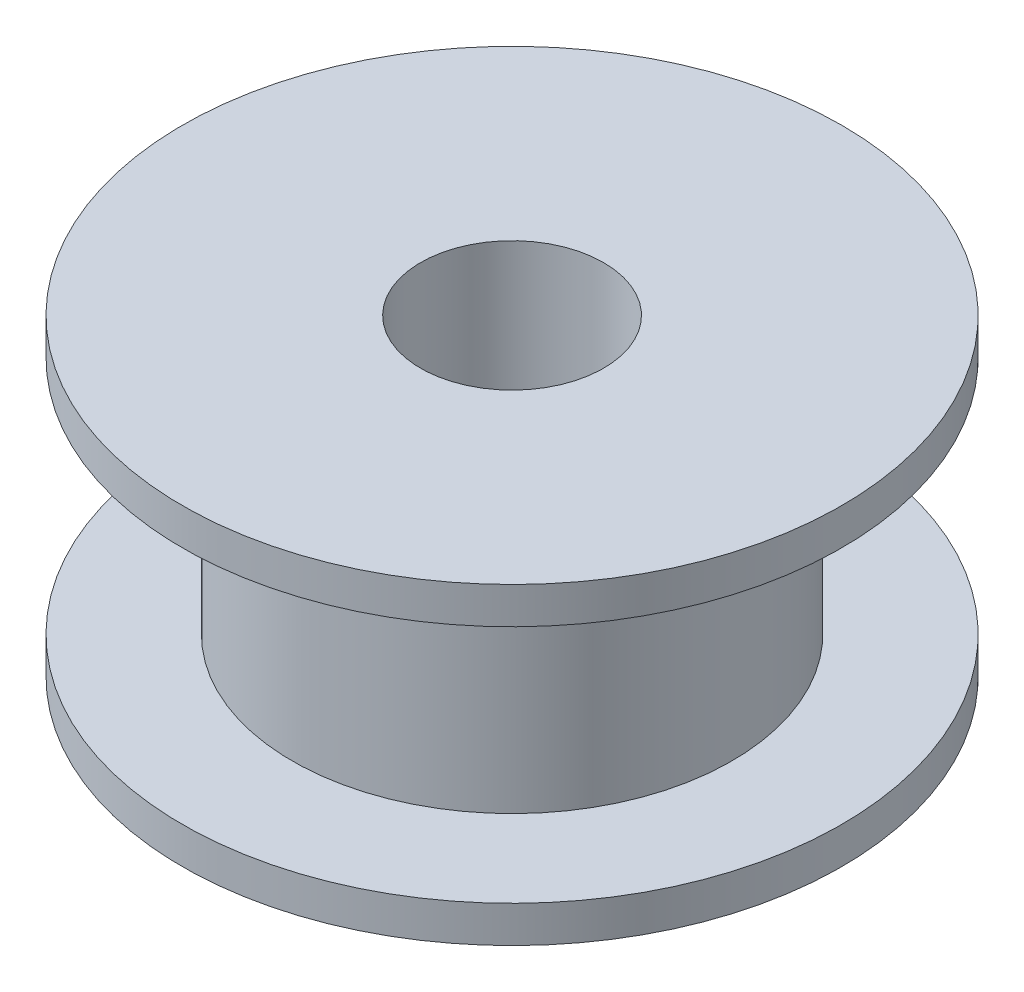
SolidWorks part; units mm, degrees
ref_plane "Front Plane" through (0, 0, 0) normal (0, 0, 1) x (1, 0, 0)
ref_plane "Top Plane" through (0, 0, 0) normal (0, 1, 0) x (1, 0, 0)
ref_plane "Right Plane" through (0, 0, 0) normal (1, 0, 0) x (0, 0, -1)
sketch "Sketch1" plane through (0, 0, 0) normal (0, 0, 1) x (1, 0, 0)
  line L0 (0, 0) -> (2.5, 0) construction
  line L1 (2.5, 0) -> (2.5, 8.54)
  line L2 (2.5, 8.54) -> (9, 8.54)
  line L3 (9, 8.54) -> (9, 7.54)
  line L4 (9, 7.54) -> (6, 7.54)
  line L5 (6, 7.54) -> (6, 1)
  line L6 (6, 1) -> (9, 1)
  line L7 (9, 1) -> (9, 0)
  line L8 (9, 0) -> (2.5, 0)
  line L9 (0, 0) -> (0, 7.9436) construction
  dimension "D1" = 2.5
  dimension "D2" = 9
  dimension "D3" = 6
  dimension "D4" = 1
  dimension "D5" = 8.54
revolve "Revolve1" add sketch "Sketch1" angle 360 about L9
